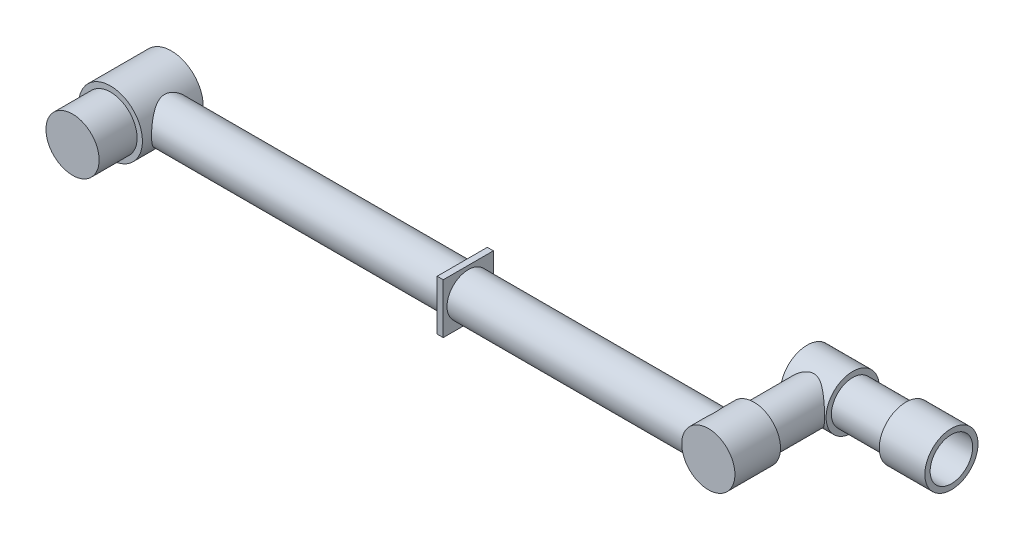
SolidWorks part; units mm, degrees
ref_plane "Front Plane" through (0, 0, 0) normal (0, 0, 1) x (1, 0, 0)
ref_plane "Top Plane" through (0, 0, 0) normal (0, 1, 0) x (1, 0, 0)
ref_plane "Right Plane" through (0, 0, 0) normal (1, 0, 0) x (0, 0, -1)
sketch "Sketch1" plane through (0, 0, 0) normal (0, 0, 1) x (1, 0, 0)
  circle A1 centre (0, 0) radius 210
extrude "Boss-Extrude1" add sketch "Sketch1" against normal mid plane 400 contours A1
sketch "Sketch4" plane through (0, 0, 200) normal (0, 0, 1) x (1, 0, 0)
  circle A0 centre (0, 0) radius 175
extrude "Boss-Extrude2" add sketch "Sketch4" along normal blind 250
sketch "Sketch5" plane through (0, 0, 0) normal (1, 0, 0) x (0, 0, -1)
  line L0 (701.25, 0) -> (-701.25, 0) construction
  circle A0 centre (0, 0) radius 140
extrude "Boss-Extrude3" add sketch "Sketch5" along normal blind 3885
sketch "Sketch7" plane through (0, 0, 0) normal (0, 0, 1) x (1, 0, 0)
  line L0 (3885, -140) -> (3885, 140) construction
  circle A0 centre (3885, 0) radius 175
extrude "Boss-Extrude4" add sketch "Sketch7" along normal mid plane 300
sketch "Sketch8" plane through (0, 0, -150) normal (0, 0, -1) x (-1, 0, 0)
  circle A0 centre (-3885, 0) radius 140
extrude "Boss-Extrude5" add sketch "Sketch8" along normal blind 500 contours A0
ref_plane "Plane1" through (3885, 0, 0) normal (1, 0, 0) x (0, 0, -1)
sketch "Sketch9" plane through (3885, 0, 0) normal (1, 0, 0) x (0, 0, -1)
  line L0 (0, 231) -> (0, -231) construction
  circle A0 centre (650, 0) radius 175
extrude "Boss-Extrude6" add sketch "Sketch9" along normal mid plane 300 contours A0
sketch "Sketch10" plane through (4035, 0, 0) normal (1, 0, 0) x (0, 0, -1)
  circle A0 centre (650, 0) radius 140
extrude "Boss-Extrude7" add sketch "Sketch10" along normal blind 500
sketch "Sketch12" plane through (4535, 0, 0) normal (1, 0, 0) x (0, 0, -1)
  circle A0 centre (650, 0) radius 175
extrude "Boss-Extrude8" add sketch "Sketch12" along normal mid plane 300
sketch "Sketch13" plane through (4685, 0, 0) normal (1, 0, 0) x (0, 0, -1)
  circle A0 centre (650, 0) radius 140
extrude "Cut-Extrude3" cut sketch "Sketch13" against normal blind 220
ref_plane "Plane2" through (2135, 0, 0) normal (1, 0, 0) x (0, 0, -1)
sketch "Sketch14" plane through (2135, 0, 0) normal (1, 0, 0) x (0, 0, -1)
  line L1 (-165, -165) -> (165, -165)
  line L2 (-165, -165) -> (-165, 165)
  line L3 (-165, 165) -> (165, 165)
  line L4 (165, -165) -> (165, 165)
  line L5 (-165, -165) -> (165, 165) construction
  line L6 (-165, 165) -> (165, -165) construction
  point P0 (0, 0)
extrude "Boss-Extrude9" add sketch "Sketch14" along normal mid plane 40
equation "\"connector1_l\"= 250"
equation "\"connector1_d\"= 350"
equation "\"connector2_l\"= 220"
equation "\"connector2_d\"= 280"
equation "\"member1_d\"= 350"
equation "\"member2_d\"= 280"
equation "\"end_l\" = 400"
equation "\"end_d\" = 420"
equation "\"p1_m2_l\" = 250"
equation "\"p1_m1_l\" = 200"
equation "\"p2_m_l\" = 7500"
equation "\"p3_m_l\" = 4000"
equation "\"p3_offset\" = 400"
equation "\"D1@Sketch1\"=\"end_d\""
equation "\"D1@Boss-Extrude1\"=\"end_l\""
equation "\"D1@Sketch4\"=\"connector1_d\""
equation "\"D1@Boss-Extrude2\"= \"connector1_l\""
equation "\"D1@Sketch5\"=\"member2_d\""
equation "\"end2_l\" = 300"
equation "\"end2_d\" = 350"
equation "\"D1@Boss-Extrude3\"=\"end2_d\"/2 + \"p4_m_l\" +\"end_d\"/2"
equation "\"p4_m_l\" = 3500"
equation "\"D1@Sketch7\"=\"end2_d\""
equation "\"D1@Boss-Extrude4\"=\"end2_l\""
equation "\"D1@Sketch8\"=\"member2_d\""
equation "\"D1@Plane1\"=\"p4_m_l\" +\"end_d\"/2 +\"end2_d\"/2"
equation "\"D1@Sketch9\"=500 +\"end2_l\"/2 "
equation "\"D2@Sketch9\"=\"end2_d\""
equation "\"D1@Boss-Extrude6\"=\"end2_l\""
equation "\"D1@Sketch10\"=\"member2_d\""
equation "\"D1@Sketch12\"=\"end2_d\""
equation "\"D1@Boss-Extrude8\"=\"end2_l\""
equation "\"D1@Sketch13\"=\"connector2_d\""
equation "\"D1@Cut-Extrude3\"=\"connector2_l\""
equation "\"D1@Plane2\"=\"p4_m_l\"/2 +(\"end2_d\"+\"end_d\")/2"
equation "\"D1@Sketch14\"=\"member2_d\"+50"
